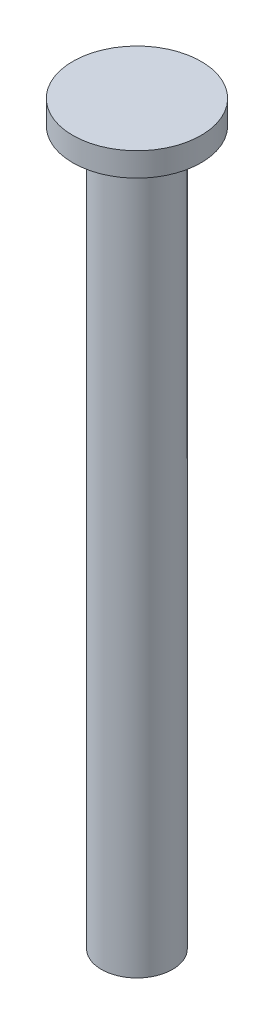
SolidWorks part; units mm, degrees
ref_plane "Ön Düzlem" through (0, 0, 0) normal (0, 0, 1) x (1, 0, 0)
ref_plane "Üst Düzlem" through (0, 0, 0) normal (0, 1, 0) x (1, 0, 0)
ref_plane "Sağ Düzlem" through (0, 0, 0) normal (1, 0, 0) x (0, 0, -1)
sketch "Çizim2" plane through (0, 0, 0) normal (0, 1, 0) x (1, 0, 0)
  circle A0 centre (0, 0) radius 2.7
extrude "Yükseklik-Ekstrüzyon1" add sketch "Çizim2" along normal blind 1
sketch "Çizim3" plane through (0, 0, 0) normal (0, -1, 0) x (1, 0, 0)
  circle A0 centre (0, 0) radius 1.5
  dimension "D1" = 3
extrude "Yükseklik-Ekstrüzyon2" add sketch "Çizim3" along normal blind 30
